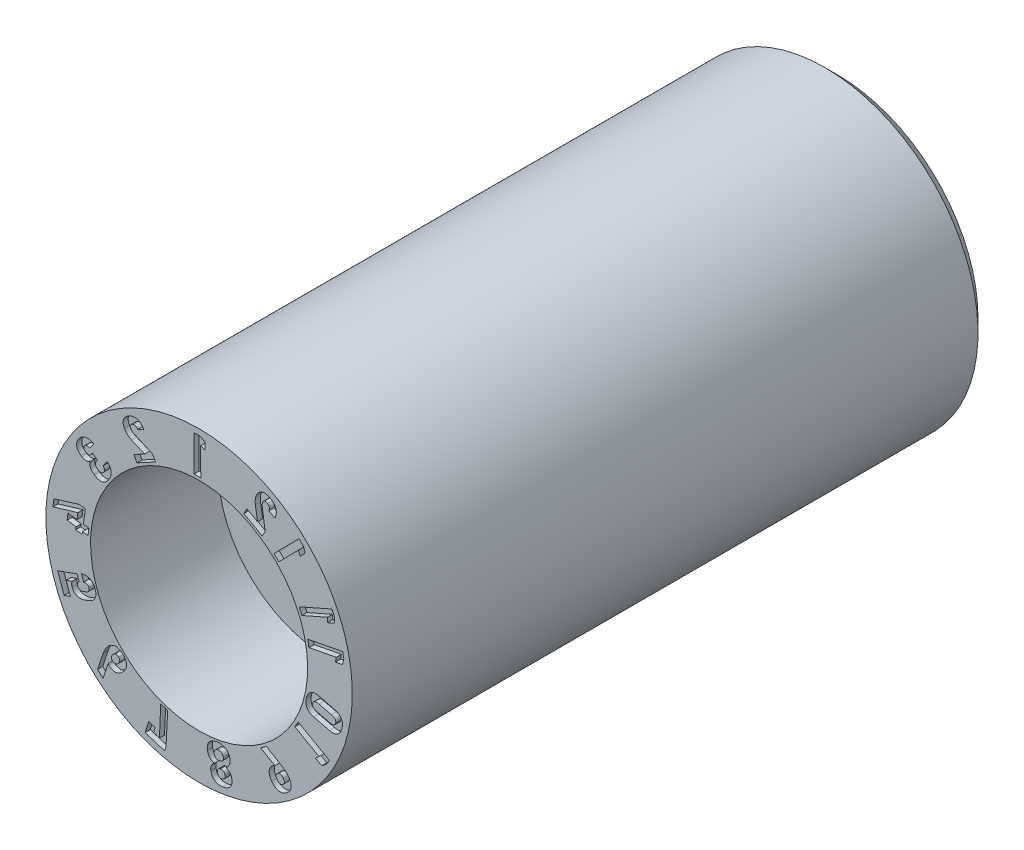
SolidWorks part; units mm, degrees
ref_plane "Front Plane" through (0, 0, 0) normal (0, 0, 1) x (1, 0, 0)
ref_plane "Top Plane" through (0, 0, 0) normal (0, 1, 0) x (1, 0, 0)
ref_plane "Right Plane" through (0, 0, 0) normal (1, 0, 0) x (0, 0, -1)
sketch "Sketch1" plane through (0, 0, 0) normal (1, 0, 0) x (0, 0, -1)
  line L0 (0, 0) -> (9.6542, 0) construction
  line L2 (25, 3) -> (25, 5.5)
  line L4 (24.5, 6) -> (0, 6)
  line L5 (0, 6) -> (0, 4.25)
  line L7 (0, 4.25) -> (5, 4.25)
  line L8 (5, 4.25) -> (5, 1.5)
  line L9 (5, 1.5) -> (18, 1.5)
  line L10 (25, 3) -> (18, 3)
  line L11 (18, 1.5) -> (18, 3)
  line L12 (25, 5.5) -> (24.5, 6)
  point P6 (25, 6)
  dimension "D1" = 25
  dimension "D2" = 12
  dimension "D3" = 8.5
  dimension "D4" = 5
  dimension "D5" = 3
  dimension "D6" = 6
  dimension "D7" = 7
revolve "Revolve1" add sketch "Sketch1" angle 360 about L0
sketch "Sketch2" plane through (0, 0, 0) normal (0, 0, 1) x (1, 0, 0)
  line L0 (-0.1978, 4.3616) -> (0.0666, 4.3632)
  line L1 (0.0666, 4.3632) -> (0.0607, 5.4564)
  line L2 (0.0607, 5.4564) -> (0.2322, 5.3923)
  line L3 (0.2322, 5.3923) -> (0.2307, 5.6736)
  line L4 (0.2307, 5.6736) -> (0.0206, 5.7669)
  line L5 (0.0206, 5.7669) -> (-0.2052, 5.7656)
  line L6 (-0.2052, 5.7656) -> (-0.1978, 4.3616)
  line L7 (-1.8183, 4.2261) -> (-2.5405, 4.5533)
  line L8 (-2.6815, 4.6706) -> (-2.6825, 4.6723)
  line L9 (-2.4005, 4.7723) -> (-2.4001, 4.7714)
  line L10 (-2.4001, 4.7714) -> (-2.1623, 4.8998)
  line L11 (-2.1623, 4.8998) -> (-2.1627, 4.9007)
  line L12 (-2.9247, 4.5502) -> (-2.9243, 4.5492)
  line L13 (-2.643, 4.2936) -> (-2.1333, 4.0748)
  line L14 (-2.1333, 4.0748) -> (-2.554, 3.8474)
  line L15 (-2.554, 3.8474) -> (-2.4333, 3.6239)
  line L16 (-2.4333, 3.6239) -> (-1.7055, 4.017)
  line L17 (-1.7055, 4.017) -> (-1.8183, 4.2261)
  line L18 (-3.6024, 3.083) -> (-3.7584, 2.8613)
  line L19 (-3.9522, 2.6271) -> (-3.9789, 2.6457)
  line L20 (-4.0412, 2.8455) -> (-3.9734, 2.9421)
  line L21 (-3.9734, 2.9421) -> (-4.1805, 3.0877)
  line L22 (-4.1805, 3.0877) -> (-4.2483, 2.9911)
  line L23 (-4.4264, 2.9882) -> (-4.4456, 3.0019)
  line L24 (-4.281, 3.2016) -> (-4.1257, 3.4228)
  line L25 (-4.6298, 2.7867) -> (-4.5953, 2.7624)
  line L26 (-4.1243, 2.4038) -> (-4.0898, 2.3795)
  line L27 (-4.6938, 1.0856) -> (-5.6844, 0.7836)
  line L28 (-5.6844, 0.7836) -> (-5.7241, 0.488)
  line L29 (-5.7241, 0.488) -> (-4.7466, 0.78)
  line L30 (-4.7466, 0.78) -> (-4.7805, 0.527)
  line L31 (-4.8301, 0.157) -> (-4.5784, 0.1231)
  line L32 (-4.5784, 0.1231) -> (-4.5638, 0.2318)
  line L33 (-4.4535, 1.0534) -> (-4.6938, 1.0856)
  line L34 (-5.1318, 0.5742) -> (-5.1669, 0.3128)
  line L35 (-5.1669, 0.3128) -> (-4.8155, 0.2656)
  line L36 (-4.3502, 0.2031) -> (-4.3152, 0.4645)
  line L37 (-4.3152, 0.4645) -> (-4.5287, 0.4932)
  line L38 (-4.6071, -1.2176) -> (-4.6079, -1.2179)
  line L39 (-4.6079, -1.2179) -> (-4.5183, -1.4672)
  line L40 (-4.5183, -1.4672) -> (-4.5174, -1.4668)
  line L41 (-4.4271, -1.7492) -> (-4.538, -1.7891)
  line L42 (-4.6929, -1.5442) -> (-4.7767, -1.3115)
  line L43 (-4.7767, -1.3115) -> (-5.5365, -1.585)
  line L44 (-5.5365, -1.585) -> (-5.2809, -2.2949)
  line L45 (-5.2809, -2.2949) -> (-5.0409, -2.2084)
  line L46 (-5.0409, -2.2084) -> (-5.2069, -1.7477)
  line L47 (-5.2069, -1.7477) -> (-4.9734, -1.6636)
  line L48 (-4.4483, -2.0384) -> (-4.3374, -1.9984)
  line L49 (-3.5682, -3.1669) -> (-3.5687, -3.1675)
  line L50 (-3.7645, -3.5148) -> (-3.9732, -4.1458)
  line L51 (-3.9732, -4.1458) -> (-3.7569, -4.3508)
  line L52 (-3.7569, -4.3508) -> (-3.5638, -3.7468)
  line L54 (-2.979, -3.7333) -> (-2.9785, -3.7327)
  line L55 (-3.158, -3.5396) -> (-3.1588, -3.5405)
  line L56 (-3.3689, -3.3394) -> (-3.3684, -3.3388)
  line L57 (-1.2952, -5.4331) -> (-1.2278, -4.1706)
  line L58 (-1.2278, -4.1706) -> (-1.5007, -4.0851)
  line L59 (-1.5007, -4.0851) -> (-1.5536, -5.2693)
  line L60 (-1.5536, -5.2693) -> (-1.783, -5.1971)
  line L61 (-1.783, -5.1971) -> (-1.72, -4.9958)
  line L62 (-1.72, -4.9958) -> (-1.9718, -4.917)
  line L63 (-1.9718, -4.917) -> (-2.111, -5.3609)
  line L64 (-2.111, -5.3609) -> (-1.3477, -5.6003)
  line L65 (-1.3477, -5.6003) -> (-1.2952, -5.4331)
  line L66 (0.3251, -4.7254) -> (0.3289, -4.7482)
  line L67 (0.457, -5.3502) -> (0.4629, -5.3865)
  line L68 (1.2851, -5.2516) -> (1.2792, -5.2154)
  line L69 (1.2081, -4.6038) -> (1.2043, -4.581)
  line L70 (0.9492, -4.6618) -> (0.9516, -4.6752)
  line L71 (0.5947, -4.733) -> (0.5924, -4.7188)
  line L72 (1.0162, -5.2477) -> (1.0183, -5.2611)
  line L73 (0.7186, -5.3091) -> (0.7162, -5.2948)
  line L75 (2.8434, -4.5302) -> (2.8441, -4.531)
  line L76 (3.5021, -4.0395) -> (3.5017, -4.0391)
  line L77 (3.1959, -3.7908) -> (2.637, -3.4559)
  line L78 (2.637, -3.4559) -> (2.412, -3.622)
  line L79 (2.412, -3.622) -> (2.9688, -3.9429)
  line L80 (3.2964, -4.2058) -> (3.297, -4.2069)
  line L81 (3.061, -4.3795) -> (3.0604, -4.3787)
  line L82 (3.8791, -2.0036) -> (3.7488, -2.2328)
  line L83 (3.7488, -2.2328) -> (4.6977, -2.7714)
  line L84 (4.6977, -2.7714) -> (4.5573, -2.888)
  line L85 (4.5573, -2.888) -> (4.8014, -3.0264)
  line L86 (4.8014, -3.0264) -> (4.9868, -2.8912)
  line L87 (4.9868, -2.8912) -> (5.0981, -2.6952)
  line L88 (5.0981, -2.6952) -> (3.8791, -2.0036)
  line L89 (4.4892, -1.5312) -> (5.1078, -1.6828)
  line L90 (5.3076, -0.8689) -> (4.6889, -0.7172)
  line L91 (4.6916, -0.9897) -> (5.1791, -1.1092)
  line L92 (5.1052, -1.4103) -> (4.6177, -1.2909)
  line L93 (4.2522, 0.9883) -> (4.302, 0.7293)
  line L94 (4.302, 0.7293) -> (5.3716, 0.9348)
  line L95 (5.3716, 0.9348) -> (5.3404, 0.7554)
  line L96 (5.3404, 0.7554) -> (5.6152, 0.8084)
  line L97 (5.6152, 0.8084) -> (5.6683, 1.0311)
  line L98 (5.6683, 1.0311) -> (5.6258, 1.2522)
  line L99 (5.6258, 1.2522) -> (4.2522, 0.9883)
  line L100 (3.9208, 1.9201) -> (4.0278, 1.6782)
  line L101 (4.0278, 1.6782) -> (5.0264, 2.1199)
  line L102 (5.0264, 2.1199) -> (5.0364, 1.9378)
  line L103 (5.0364, 1.9378) -> (5.2931, 2.0512)
  line L104 (5.2931, 2.0512) -> (5.295, 2.2808)
  line L105 (5.295, 2.2808) -> (5.2037, 2.4872)
  line L106 (5.2037, 2.4872) -> (3.9208, 1.9201)
  line L107 (2.9353, 3.2325) -> (3.1233, 3.0474)
  line L108 (3.1233, 3.0474) -> (3.8876, 3.8238)
  line L109 (3.8876, 3.8238) -> (3.9639, 3.6584)
  line L110 (3.9639, 3.6584) -> (4.1603, 3.858)
  line L111 (4.1603, 3.858) -> (4.0774, 4.0721)
  line L112 (4.0774, 4.0721) -> (3.917, 4.23)
  line L113 (3.917, 4.23) -> (2.9353, 3.2325)
  line L114 (2.5868, 3.8042) -> (2.4755, 4.5868)
  line L115 (2.4987, 4.7685) -> (2.4996, 4.7697)
  line L116 (2.734, 4.5859) -> (2.7336, 4.585)
  line L117 (2.7336, 4.585) -> (2.9692, 4.4536)
  line L118 (2.9692, 4.4536) -> (2.9696, 4.4545)
  line L119 (2.2672, 4.9085) -> (2.2668, 4.9075)
  line L120 (2.2021, 4.5337) -> (2.2905, 3.9883)
  line L121 (2.2905, 3.9883) -> (1.8741, 4.2206)
  line L122 (1.8741, 4.2206) -> (1.7506, 3.9993)
  line L123 (1.7506, 3.9993) -> (2.4712, 3.5972)
  line L124 (2.4712, 3.5972) -> (2.5868, 3.8042)
  line L125 (-4.8155, 0.2656) -> (-4.8301, 0.157)
  line L126 (-4.7805, 0.527) -> (-5.1318, 0.5742)
  line L127 (-4.5638, 0.2318) -> (-4.3502, 0.2031)
  line L128 (-4.5287, 0.4932) -> (-4.4535, 1.0534)
  circle A0 centre (0, 0) radius 4.375 construction
  spline S0 degree 3 poles (-2.5405, 4.5533) (-2.5708, 4.5672) (-2.6075, 4.5879) (-2.6434, 4.6209) (-2.6631, 4.6416) (-2.6751, 4.6588) (-2.6815, 4.6706) knots 0 0 0 0 0.540031 0.665532 0.783527 1 1 1 1
  spline S1 degree 3 poles (-2.6825, 4.6723) (-2.691, 4.6872) (-2.6992, 4.7113) (-2.6988, 4.7442) (-2.6926, 4.7672) (-2.6809, 4.789) (-2.657, 4.8174) (-2.6325, 4.8334) (-2.6149, 4.843) knots 0 0 0 0 0.246786 0.35691 0.469448 0.586307 0.710254 1 1 1 1
  spline S2 degree 3 poles (-2.6149, 4.843) (-2.5973, 4.8524) (-2.5688, 4.8625) (-2.5294, 4.8627) (-2.5009, 4.8563) (-2.4734, 4.8439) (-2.4367, 4.8186) (-2.4141, 4.7919) (-2.4005, 4.7723) knots 0 0 0 0 0.240301 0.353786 0.468513 0.587497 0.712892 1 1 1 1
  spline S3 degree 3 poles (-2.1627, 4.9007) (-2.1846, 4.9354) (-2.2212, 4.9835) (-2.2789, 5.0369) (-2.3239, 5.0689) (-2.3711, 5.0942) (-2.4201, 5.1126) (-2.4708, 5.1229) (-2.5228, 5.1266) (-2.5756, 5.1229) (-2.648, 5.1073) (-2.7004, 5.0859) (-2.734, 5.0675) knots 0 0 0 0 0.185247 0.270908 0.353799 0.433963 0.511943 0.589015 0.666847 0.746166 0.827199 1 1 1 1
  spline S4 degree 3 poles (-2.734, 5.0675) (-2.7696, 5.0481) (-2.8196, 5.016) (-2.8765, 4.9646) (-2.9108, 4.9247) (-2.9382, 4.8828) (-2.9584, 4.839) (-2.9717, 4.7936) (-2.9769, 4.7464) (-2.9753, 4.6981) (-2.9621, 4.6306) (-2.9418, 4.5818) (-2.9247, 4.5502) knots 0 0 0 0 0.194583 0.283015 0.366623 0.445927 0.521986 0.596945 0.671952 0.748458 0.827747 1 1 1 1
  spline S5 degree 3 poles (-2.9243, 4.5492) (-2.9089, 4.5214) (-2.8827, 4.481) (-2.8403, 4.4325) (-2.8057, 4.398) (-2.7682, 4.3665) (-2.715, 4.3295) (-2.6726, 4.3062) (-2.643, 4.2936) knots 0 0 0 0 0.246636 0.37153 0.498651 0.625609 0.751024 1 1 1 1
  spline S6 degree 3 poles (-3.5398, 2.4933) (-3.5166, 2.526) (-3.4869, 2.5773) (-3.46, 2.6499) (-3.447, 2.7034) (-3.4407, 2.7567) (-3.4423, 2.8092) (-3.4506, 2.8606) (-3.4662, 2.9108) (-3.4893, 2.9587) (-3.5308, 3.0203) (-3.5722, 3.0595) (-3.6024, 3.083) knots 0 0 0 0 0.181513 0.26641 0.349352 0.42998 0.508355 0.58625 0.665066 0.745087 0.826278 1 1 1 1
  spline S7 degree 3 poles (-3.7584, 2.8613) (-3.7484, 2.852) (-3.7348, 2.8371) (-3.7206, 2.8151) (-3.7123, 2.7987) (-3.707, 2.7817) (-3.7035, 2.7647) (-3.7026, 2.7476) (-3.7036, 2.7303) (-3.7072, 2.7132) (-3.7154, 2.6901) (-3.7246, 2.6737) (-3.732, 2.6633) knots 0 0 0 0 0.185669 0.27185 0.355025 0.435165 0.512269 0.590352 0.667877 0.746758 0.826658 1 1 1 1
  spline S8 degree 3 poles (-3.732, 2.6633) (-3.7447, 2.645) (-3.7669, 2.6203) (-3.804, 2.5999) (-3.8324, 2.5918) (-3.8621, 2.5903) (-3.9043, 2.5982) (-3.9337, 2.6142) (-3.9522, 2.6271) knots 0 0 0 0 0.265738 0.383017 0.496928 0.612242 0.731703 1 1 1 1
  spline S9 degree 3 poles (-3.9789, 2.6457) (-3.9981, 2.6595) (-4.0248, 2.6812) (-4.0496, 2.7168) (-4.0609, 2.7427) (-4.0664, 2.769) (-4.0639, 2.8053) (-4.0521, 2.8306) (-4.0412, 2.8455) knots 0 0 0 0 0.300575 0.428718 0.545676 0.656478 0.765355 1 1 1 1
  spline S10 degree 3 poles (-4.2483, 2.9911) (-4.2566, 2.9784) (-4.2735, 2.9628) (-4.3014, 2.9512) (-4.3241, 2.9485) (-4.3484, 2.9512) (-4.3843, 2.9616) (-4.4098, 2.9766) (-4.4264, 2.9882) knots 0 0 0 0 0.226778 0.333314 0.445235 0.564595 0.695767 1 1 1 1
  spline S11 degree 3 poles (-4.4456, 3.0019) (-4.4612, 3.0131) (-4.4828, 3.0311) (-4.502, 3.061) (-4.5105, 3.0832) (-4.5134, 3.106) (-4.5102, 3.1377) (-4.4991, 3.1599) (-4.4894, 3.1732) knots 0 0 0 0 0.288125 0.411925 0.528489 0.640573 0.752467 1 1 1 1
  spline S12 degree 3 poles (-4.4894, 3.1732) (-4.4828, 3.1826) (-4.4713, 3.1957) (-4.4524, 3.2084) (-4.4374, 3.2165) (-4.4208, 3.2218) (-4.4035, 3.226) (-4.3849, 3.2267) (-4.3655, 3.2263) (-4.3453, 3.2234) (-4.3165, 3.2166) (-4.2953, 3.208) (-4.281, 3.2016) knots 0 0 0 0 0.150328 0.223515 0.297446 0.371959 0.449583 0.529747 0.613909 0.702218 0.795553 1 1 1 1
  spline S13 degree 3 poles (-4.1257, 3.4228) (-4.1607, 3.4428) (-4.2147, 3.468) (-4.2899, 3.4872) (-4.3445, 3.4941) (-4.3979, 3.494) (-4.4497, 3.4876) (-4.4994, 3.4735) (-4.5468, 3.453) (-4.5917, 3.4265) (-4.6477, 3.3827) (-4.6832, 3.3419) (-4.7039, 3.3122) knots 0 0 0 0 0.185403 0.271955 0.355808 0.43751 0.516725 0.595164 0.673981 0.753613 0.833638 1 1 1 1
  spline S14 degree 3 poles (-4.7039, 3.3122) (-4.7205, 3.2882) (-4.7432, 3.2519) (-4.7664, 3.2015) (-4.7794, 3.1651) (-4.7883, 3.129) (-4.7936, 3.0934) (-4.7947, 3.0582) (-4.7916, 3.0237) (-4.785, 2.9899) (-4.7744, 2.9571) (-4.7599, 2.9255) (-4.7417, 2.895) (-4.7191, 2.8661) (-4.6836, 2.8277) (-4.6521, 2.8026) (-4.6298, 2.7867) knots 0 0 0 0 0.145221 0.212039 0.275498 0.336822 0.396212 0.454116 0.511301 0.568162 0.624888 0.681779 0.740523 0.801036 0.863692 1 1 1 1
  spline S15 degree 3 poles (-4.5953, 2.7624) (-4.5703, 2.7451) (-4.5303, 2.723) (-4.4725, 2.7087) (-4.4293, 2.7043) (-4.386, 2.7071) (-4.3276, 2.7201) (-4.2868, 2.7408) (-4.2612, 2.7575) knots 0 0 0 0 0.256538 0.378141 0.499462 0.620241 0.742004 1 1 1 1
  spline S16 degree 3 poles (-4.2612, 2.7575) (-4.2678, 2.7423) (-4.2749, 2.7186) (-4.28, 2.6864) (-4.282, 2.6627) (-4.2811, 2.6391) (-4.2777, 2.6157) (-4.2724, 2.5922) (-4.2646, 2.569) (-4.2546, 2.5462) (-4.2422, 2.524) (-4.2281, 2.5022) (-4.2115, 2.4813) (-4.193, 2.4608) (-4.1646, 2.4338) (-4.1408, 2.4156) (-4.1243, 2.4038) knots 0 0 0 0 0.120514 0.178963 0.236486 0.293076 0.350257 0.408016 0.467449 0.527699 0.589262 0.651768 0.715782 0.783012 0.852532 1 1 1 1
  spline S17 degree 3 poles (-4.0898, 2.3795) (-4.0589, 2.3576) (-4.0104, 2.3298) (-3.942, 2.307) (-3.8925, 2.2977) (-3.8435, 2.2958) (-3.7955, 2.3023) (-3.7484, 2.3158) (-3.7027, 2.337) (-3.6586, 2.3657) (-3.6006, 2.415) (-3.5629, 2.4604) (-3.5398, 2.4933) knots 0 0 0 0 0.178207 0.259967 0.338031 0.414007 0.489005 0.564651 0.643104 0.724692 0.8109 1 1 1 1
  spline S18 degree 3 poles (-4.0723, -1.4624) (-4.084, -1.4281) (-4.1085, -1.3804) (-4.1506, -1.3236) (-4.1871, -1.2871) (-4.228, -1.2559) (-4.2729, -1.2309) (-4.3216, -1.2118) (-4.3738, -1.1994) (-4.4292, -1.1936) (-4.5081, -1.1947) (-4.5676, -1.2063) (-4.6071, -1.2176) knots 0 0 0 0 0.165263 0.244175 0.322923 0.400785 0.478837 0.557609 0.639406 0.724106 0.811786 1 1 1 1
  spline S19 degree 3 poles (-4.5174, -1.4668) (-4.4947, -1.4606) (-4.4607, -1.4564) (-4.4169, -1.4607) (-4.3883, -1.4696) (-4.3628, -1.4833) (-4.3341, -1.5092) (-4.3191, -1.5346) (-4.3128, -1.5533) knots 0 0 0 0 0.286425 0.412421 0.532755 0.648554 0.760969 1 1 1 1
  spline S20 degree 3 poles (-4.3128, -1.5533) (-4.3056, -1.5729) (-4.2994, -1.6038) (-4.3063, -1.6439) (-4.3184, -1.6707) (-4.3369, -1.695) (-4.3709, -1.7257) (-4.4042, -1.7403) (-4.4271, -1.7492) knots 0 0 0 0 0.244768 0.357262 0.468879 0.585371 0.710839 1 1 1 1
  spline S21 degree 3 poles (-4.538, -1.7891) (-4.5611, -1.7978) (-4.5956, -1.8064) (-4.6406, -1.8071) (-4.6695, -1.8012) (-4.695, -1.7904) (-4.7243, -1.7675) (-4.7382, -1.7426) (-4.7446, -1.725) knots 0 0 0 0 0.302893 0.431393 0.55004 0.661203 0.768793 1 1 1 1
  spline S22 degree 3 poles (-4.7446, -1.725) (-4.7507, -1.7083) (-4.7566, -1.6825) (-4.7559, -1.648) (-4.7512, -1.6237) (-4.7424, -1.6007) (-4.7252, -1.5719) (-4.7068, -1.5541) (-4.6929, -1.5442) knots 0 0 0 0 0.263348 0.385872 0.507659 0.627206 0.748083 1 1 1 1
  spline S23 degree 3 poles (-4.9734, -1.6636) (-4.9794, -1.677) (-4.9855, -1.699) (-4.989, -1.7303) (-4.9891, -1.7561) (-4.9872, -1.7826) (-4.9823, -1.8172) (-4.9756, -1.8424) (-4.9699, -1.8586) knots 0 0 0 0 0.220311 0.341953 0.473175 0.608808 0.741307 1 1 1 1
  spline S24 degree 3 poles (-4.9699, -1.8586) (-4.9586, -1.8907) (-4.9362, -1.9359) (-4.8949, -1.9869) (-4.8602, -2.0183) (-4.8211, -2.0436) (-4.7778, -2.0622) (-4.7308, -2.0744) (-4.68, -2.0801) (-4.6261, -2.0795) (-4.5473, -2.0695) (-4.4881, -2.0525) (-4.4483, -2.0384) knots 0 0 0 0 0.163572 0.239328 0.313613 0.387363 0.461653 0.538789 0.6198 0.70611 0.797006 1 1 1 1
  spline S25 degree 3 poles (-4.3374, -1.9984) (-4.2974, -1.9845) (-4.2413, -1.9582) (-4.1752, -1.9127) (-4.1345, -1.875) (-4.1006, -1.8339) (-4.0741, -1.7892) (-4.0546, -1.7414) (-4.0429, -1.6903) (-4.0387, -1.6364) (-4.0431, -1.5589) (-4.059, -1.5009) (-4.0723, -1.4624) knots 0 0 0 0 0.18694 0.272023 0.353193 0.431093 0.506534 0.581498 0.658173 0.737159 0.819461 1 1 1 1
  spline S26 degree 3 poles (-2.9815, -3.1418) (-3.0105, -3.1143) (-3.0568, -3.0778) (-3.1244, -3.0425) (-3.1747, -3.0248) (-3.2253, -3.0153) (-3.2761, -3.0134) (-3.3268, -3.0196) (-3.3774, -3.0333) (-3.4271, -3.0554) (-3.4943, -3.0962) (-3.5394, -3.137) (-3.5682, -3.1669) knots 0 0 0 0 0.180127 0.262705 0.342108 0.418644 0.493746 0.569602 0.647518 0.728441 0.81338 1 1 1 1
  spline S27 degree 3 poles (-3.5687, -3.1675) (-3.5868, -3.1864) (-3.6122, -3.2171) (-3.6433, -3.2611) (-3.6902, -3.3347) (-3.7218, -3.4014) (-3.7435, -3.4566) knots 0 0 0 0 0.230619 0.351394 0.476039 1 1 1 1
  spline S28 degree 3 poles (-3.7435, -3.4566) (-3.7473, -3.4663) (-3.7553, -3.4853) (-3.7612, -3.5051) (-3.7645, -3.5148) knots 0 0 0 0 0.50536 1 1 1 1
  spline S29 degree 3 poles (-3.5638, -3.7468) (-3.5539, -3.7607) (-3.5424, -3.7734) (-3.5301, -3.7852) knots 0.758677 0.758677 0.758677 0.758677 1 1 1 1
  spline S30 degree 3 poles (-3.5301, -3.7852) (-3.5041, -3.8101) (-3.4622, -3.8424) (-3.4003, -3.8721) (-3.3541, -3.8862) (-3.3071, -3.8933) (-3.2595, -3.892) (-3.2116, -3.8839) (-3.1639, -3.8679) (-3.1162, -3.8452) (-3.0517, -3.8029) (-3.0068, -3.7634) (-2.979, -3.7333) knots 0 0 0 0 0.171863 0.250291 0.326567 0.401554 0.476517 0.552896 0.632432 0.716094 0.804581 1 1 1 1
  spline S31 degree 3 poles (-2.9785, -3.7327) (-2.9494, -3.7027) (-2.9112, -3.6546) (-2.8733, -3.5849) (-2.8537, -3.5335) (-2.8417, -3.4821) (-2.8379, -3.4307) (-2.8422, -3.3797) (-2.8547, -3.3295) (-2.8748, -3.2801) (-2.9133, -3.214) (-2.9522, -3.1695) (-2.9815, -3.1418) knots 0 0 0 0 0.186979 0.272364 0.353583 0.431717 0.507486 0.58272 0.659285 0.738013 0.820087 1 1 1 1
  spline S32 degree 3 poles (-3.1562, -3.3258) (-3.1409, -3.3402) (-3.1211, -3.3642) (-3.1075, -3.4018) (-3.1048, -3.4298) (-3.1083, -3.458) (-3.1224, -3.4974) (-3.1427, -3.5233) (-3.158, -3.5396) knots 0 0 0 0 0.260004 0.375028 0.487763 0.603253 0.723686 1 1 1 1
  spline S33 degree 3 poles (-3.1588, -3.5405) (-3.1766, -3.5588) (-3.2044, -3.5837) (-3.2468, -3.6043) (-3.2771, -3.6118) (-3.307, -3.6123) (-3.3469, -3.603) (-3.3731, -3.5848) (-3.3884, -3.5703) knots 0 0 0 0 0.294329 0.419072 0.536316 0.647266 0.758044 1 1 1 1
  spline S34 degree 3 poles (-3.3884, -3.5703) (-3.4041, -3.5563) (-3.4223, -3.5307) (-3.434, -3.4915) (-3.4343, -3.4614) (-3.4278, -3.4307) (-3.4094, -3.3872) (-3.3864, -3.3579) (-3.3689, -3.3394) knots 0 0 0 0 0.240144 0.350681 0.462749 0.580659 0.707141 1 1 1 1
  spline S35 degree 3 poles (-3.3684, -3.3388) (-3.353, -3.3226) (-3.328, -3.3016) (-3.2899, -3.285) (-3.262, -3.28) (-3.2342, -3.282) (-3.1961, -3.2928) (-3.1714, -3.3119) (-3.1562, -3.3258) knots 0 0 0 0 0.277582 0.398175 0.512355 0.625221 0.741294 1 1 1 1
  spline S36 degree 3 poles (0.7015, -4.2678) (0.6601, -4.2748) (0.5999, -4.2896) (0.5266, -4.3231) (0.478, -4.3522) (0.4351, -4.3861) (0.3983, -4.4243) (0.3685, -4.4669) (0.345, -4.5132) (0.3285, -4.5628) (0.3164, -4.6339) (0.3191, -4.6889) (0.3251, -4.7254) knots 0 0 0 0 0.188911 0.276657 0.361678 0.443562 0.521838 0.599287 0.676742 0.754956 0.833257 1 1 1 1
  spline S37 degree 3 poles (0.3289, -4.7482) (0.3344, -4.7822) (0.35, -4.8322) (0.3847, -4.8929) (0.4172, -4.9351) (0.4551, -4.9728) (0.5114, -5.0155) (0.56, -5.0372) (0.5935, -5.0475) knots 0 0 0 0 0.245718 0.369513 0.497226 0.624714 0.74972 1 1 1 1
  spline S38 degree 3 poles (0.5935, -5.0475) (0.5692, -5.0649) (0.5355, -5.0952) (0.5007, -5.1439) (0.4795, -5.1831) (0.4643, -5.2243) (0.4517, -5.2799) (0.4526, -5.3226) (0.457, -5.3502) knots 0 0 0 0 0.257022 0.384551 0.512171 0.638121 0.760049 1 1 1 1
  spline S39 degree 3 poles (0.4629, -5.3865) (0.4687, -5.4207) (0.4825, -5.4709) (0.5151, -5.5306) (0.5442, -5.5703) (0.5793, -5.6043) (0.6185, -5.6339) (0.6627, -5.657) (0.7107, -5.675) (0.7625, -5.6868) (0.8374, -5.6939) (0.8951, -5.6899) (0.9338, -5.6834) knots 0 0 0 0 0.166755 0.246297 0.324383 0.402008 0.479602 0.558559 0.640169 0.724632 0.812105 1 1 1 1
  spline S40 degree 3 poles (0.9338, -5.6834) (0.9724, -5.6767) (1.0287, -5.663) (1.0972, -5.6317) (1.1425, -5.6039) (1.1822, -5.5714) (1.2168, -5.5356) (1.2446, -5.4952) (1.2666, -5.4516) (1.2818, -5.4048) (1.2937, -5.3379) (1.2908, -5.286) (1.2851, -5.2516) knots 0 0 0 0 0.187909 0.275417 0.360083 0.441841 0.520725 0.597915 0.675567 0.754033 0.832948 1 1 1 1
  spline S41 degree 3 poles (1.2792, -5.2154) (1.2747, -5.1873) (1.2614, -5.1462) (1.2313, -5.097) (1.2029, -5.0632) (1.1703, -5.0328) (1.1212, -4.9983) (1.0795, -4.9806) (1.0505, -4.9724) knots 0 0 0 0 0.242453 0.363868 0.489952 0.617354 0.74325 1 1 1 1
  spline S42 degree 3 poles (1.0505, -4.9724) (1.0796, -4.9521) (1.1184, -4.9152) (1.159, -4.8569) (1.1829, -4.809) (1.201, -4.7589) (1.2147, -4.6903) (1.2139, -4.6379) (1.2081, -4.6038) knots 0 0 0 0 0.252158 0.376884 0.504108 0.631296 0.754622 1 1 1 1
  spline S43 degree 3 poles (1.2043, -4.581) (1.1981, -4.5446) (1.1837, -4.4913) (1.149, -4.4282) (1.1179, -4.3864) (1.081, -4.3499) (1.0388, -4.3193) (0.9917, -4.2947) (0.9401, -4.2763) (0.8847, -4.2639) (0.8045, -4.2564) (0.7428, -4.2608) (0.7015, -4.2678) knots 0 0 0 0 0.166471 0.245115 0.32305 0.400163 0.477805 0.556488 0.638411 0.723458 0.81117 1 1 1 1
  spline S44 degree 3 poles (0.7429, -4.5197) (0.7595, -4.5167) (0.7844, -4.5152) (0.8167, -4.5195) (0.8393, -4.5255) (0.8604, -4.5342) (0.8799, -4.5452) (0.8972, -4.5595) (0.9126, -4.5758) (0.9259, -4.5944) (0.9402, -4.6225) (0.9464, -4.6459) (0.9492, -4.6618) knots 0 0 0 0 0.179082 0.263836 0.346473 0.426937 0.506638 0.584521 0.664787 0.745258 0.82724 1 1 1 1
  spline S45 degree 3 poles (0.9516, -4.6752) (0.9541, -4.69) (0.955, -4.7124) (0.95, -4.7413) (0.9432, -4.7615) (0.9333, -4.7801) (0.9214, -4.7976) (0.9064, -4.8132) (0.8892, -4.8271) (0.8697, -4.8391) (0.8399, -4.8522) (0.8158, -4.8586) (0.799, -4.8611) knots 0 0 0 0 0.166565 0.24586 0.324124 0.401703 0.479332 0.558127 0.640221 0.724653 0.811552 1 1 1 1
  spline S46 degree 3 poles (0.799, -4.8611) (0.7822, -4.8637) (0.7572, -4.8662) (0.7248, -4.8628) (0.7024, -4.8579) (0.6815, -4.8501) (0.6626, -4.8397) (0.6452, -4.8275) (0.6303, -4.8123) (0.6173, -4.7954) (0.6032, -4.7695) (0.5973, -4.7479) (0.5947, -4.733) knots 0 0 0 0 0.188247 0.274867 0.359836 0.441322 0.52022 0.597868 0.675487 0.754323 0.833355 1 1 1 1
  spline S47 degree 3 poles (0.5924, -4.7188) (0.5897, -4.7028) (0.5885, -4.6788) (0.593, -4.6477) (0.5998, -4.626) (0.6092, -4.6057) (0.621, -4.5869) (0.6361, -4.5705) (0.6532, -4.5555) (0.673, -4.5431) (0.7021, -4.5285) (0.7264, -4.5225) (0.7429, -4.5197) knots 0 0 0 0 0.17278 0.255069 0.335188 0.415003 0.493111 0.57141 0.652579 0.735418 0.820528 1 1 1 1
  spline S48 degree 3 poles (0.8404, -5.1148) (0.8546, -5.1129) (0.8759, -5.1109) (0.9034, -5.1155) (0.9226, -5.121) (0.9404, -5.1292) (0.9568, -5.1398) (0.9715, -5.1528) (0.9844, -5.1681) (0.9957, -5.1854) (1.0081, -5.2115) (1.0138, -5.2329) (1.0162, -5.2477) knots 0 0 0 0 0.173583 0.255392 0.335492 0.414428 0.492216 0.570546 0.651075 0.734215 0.818823 1 1 1 1
  spline S49 degree 3 poles (1.0183, -5.2611) (1.0206, -5.2749) (1.0218, -5.2955) (1.0179, -5.3222) (1.0128, -5.3409) (1.0051, -5.3582) (0.9952, -5.3741) (0.9828, -5.3883) (0.9684, -5.4009) (0.9522, -5.412) (0.927, -5.4233) (0.9069, -5.4296) (0.8926, -5.4314) knots 0 0 0 0 0.175701 0.257572 0.338547 0.418149 0.495516 0.57329 0.653732 0.735586 0.819888 1 1 1 1
  spline S50 degree 3 poles (0.8926, -5.4314) (0.8785, -5.4332) (0.8573, -5.4354) (0.83, -5.4315) (0.8108, -5.427) (0.793, -5.4198) (0.7768, -5.4098) (0.7622, -5.3978) (0.7492, -5.3837) (0.7384, -5.3674) (0.7266, -5.3429) (0.7208, -5.323) (0.7186, -5.3091) knots 0 0 0 0 0.179176 0.262722 0.344582 0.424728 0.502426 0.581003 0.660377 0.741777 0.824574 1 1 1 1
  spline S51 degree 3 poles (0.7162, -5.2948) (0.7138, -5.2804) (0.7127, -5.2587) (0.7156, -5.2305) (0.721, -5.2108) (0.7284, -5.1924) (0.7385, -5.1756) (0.7504, -5.1603) (0.7649, -5.147) (0.7812, -5.1355) (0.8058, -5.1226) (0.8264, -5.1173) (0.8404, -5.1148) knots 0 0 0 0 0.178389 0.262964 0.344996 0.426393 0.504519 0.583339 0.662244 0.743344 0.825531 1 1 1 1
  spline S52 degree 3 poles (2.9688, -3.9429) (2.9676, -3.9433) (2.9574, -3.9469) (2.9285, -3.9597) (2.9028, -3.9758) (2.886, -3.9882) knots 0.564366 0.564366 0.564366 0.564366 0.581965 0.713241 1 1 1 1
  spline S53 degree 3 poles (2.886, -3.9882) (2.8589, -4.0081) (2.8222, -4.0422) (2.7852, -4.0965) (2.7649, -4.1397) (2.7509, -4.1852) (2.7436, -4.2325) (2.7436, -4.2813) (2.75, -4.3313) (2.7635, -4.3818) (2.7907, -4.4507) (2.8205, -4.4992) (2.8434, -4.5302) knots 0 0 0 0 0.165213 0.243295 0.321098 0.398558 0.4759 0.554875 0.637363 0.722439 0.810763 1 1 1 1
  spline S54 degree 3 poles (2.8441, -4.531) (2.8693, -4.5648) (2.9098, -4.6118) (2.9724, -4.6617) (3.0197, -4.6906) (3.0686, -4.7115) (3.1188, -4.7242) (3.17, -4.7292) (3.222, -4.7256) (3.2744, -4.7144) (3.3464, -4.6875) (3.3973, -4.657) (3.4298, -4.6327) knots 0 0 0 0 0.187453 0.273103 0.354468 0.432526 0.508157 0.58355 0.659808 0.738585 0.820198 1 1 1 1
  spline S55 degree 3 poles (3.4298, -4.6327) (3.4622, -4.6088) (3.5065, -4.5694) (3.553, -4.5083) (3.5789, -4.4613) (3.5971, -4.4122) (3.6072, -4.3615) (3.6096, -4.3094) (3.6038, -4.2561) (3.59, -4.202) (3.5603, -4.1269) (3.5275, -4.0737) (3.5021, -4.0395) knots 0 0 0 0 0.178257 0.259594 0.33812 0.4147 0.489866 0.565782 0.643898 0.725895 0.811719 1 1 1 1
  spline S56 degree 3 poles (3.5017, -4.0391) (3.4872, -4.0192) (3.4626, -3.9906) (3.4258, -3.9549) (3.3946, -3.928) (3.3609, -3.9013) (3.3113, -3.8645) (3.2716, -3.8384) (3.2446, -3.8207) knots 0 0 0 0 0.216947 0.333216 0.45375 0.5803 0.714146 1 1 1 1
  spline S57 degree 3 poles (3.2446, -3.8207) (3.2366, -3.8154) (3.2204, -3.8054) (3.2044, -3.795) (3.1959, -3.7908) knots 0 0 0 0 0.502406 1 1 1 1
  spline S58 degree 3 poles (3.0768, -4.1542) (3.0934, -4.1414) (3.1213, -4.1271) (3.1616, -4.122) (3.1909, -4.1258) (3.2196, -4.1357) (3.2578, -4.1602) (3.2821, -4.1859) (3.2964, -4.2058) knots 0 0 0 0 0.246067 0.358457 0.471835 0.589083 0.712499 1 1 1 1
  spline S59 degree 3 poles (3.297, -4.2069) (3.3113, -4.2257) (3.3281, -4.2556) (3.3392, -4.298) (3.3398, -4.3275) (3.334, -4.3558) (3.3162, -4.3918) (3.2944, -4.4141) (3.2774, -4.4262) knots 0 0 0 0 0.283319 0.405631 0.522186 0.634485 0.748744 1 1 1 1
  spline S60 degree 3 poles (3.2774, -4.4262) (3.2604, -4.4385) (3.2329, -4.4541) (3.1927, -4.4595) (3.1639, -4.4568) (3.1359, -4.4471) (3.0984, -4.424) (3.0747, -4.3988) (3.061, -4.3795) knots 0 0 0 0 0.252249 0.365948 0.478304 0.594067 0.716781 1 1 1 1
  spline S61 degree 3 poles (3.0604, -4.3787) (3.046, -4.359) (3.0274, -4.3286) (3.0163, -4.2848) (3.0151, -4.2546) (3.0204, -4.2258) (3.0374, -4.1888) (3.0599, -4.1667) (3.0768, -4.1542) knots 0 0 0 0 0.287505 0.411242 0.527096 0.639457 0.752084 1 1 1 1
  spline S62 degree 3 poles (4.2025, -1.0293) (4.1947, -1.0606) (4.1866, -1.1071) (4.1828, -1.1682) (4.1845, -1.2105) (4.1899, -1.2507) (4.1992, -1.2887) (4.2129, -1.3244) (4.2302, -1.3579) (4.251, -1.389) (4.2752, -1.4176) (4.3029, -1.4431) (4.3337, -1.4662) (4.3677, -1.4868) (4.4189, -1.511) (4.4605, -1.524) (4.4892, -1.5312) knots 0 0 0 0 0.147114 0.214655 0.278552 0.340153 0.39914 0.456578 0.513845 0.570705 0.626912 0.684037 0.742067 0.802468 0.864949 1 1 1 1
  spline S63 degree 3 poles (5.1078, -1.6828) (5.1368, -1.6898) (5.1799, -1.6974) (5.2368, -1.6996) (5.2767, -1.6976) (5.3149, -1.6913) (5.3513, -1.6811) (5.3859, -1.667) (5.4187, -1.649) (5.4495, -1.6272) (5.4776, -1.6016) (5.5035, -1.5724) (5.5268, -1.5393) (5.5474, -1.5024) (5.5727, -1.4469) (5.5864, -1.4018) (5.594, -1.3706) knots 0 0 0 0 0.135933 0.198749 0.259181 0.317693 0.374727 0.431 0.487859 0.544848 0.602171 0.661143 0.722378 0.786127 0.853397 1 1 1 1
  spline S64 degree 3 poles (5.594, -1.3706) (5.6015, -1.3393) (5.6104, -1.2929) (5.6138, -1.2318) (5.6128, -1.1895) (5.6073, -1.1494) (5.5982, -1.1114) (5.585, -1.0757) (5.5682, -1.0422) (5.5473, -1.0115) (5.5232, -0.9831) (5.4958, -0.957) (5.4644, -0.9344) (5.4304, -0.9134) (5.3784, -0.8896) (5.3366, -0.876) (5.3076, -0.8689) knots 0 0 0 0 0.146813 0.214284 0.278279 0.339211 0.398462 0.455807 0.512307 0.56852 0.624668 0.68185 0.740176 0.800514 0.863812 1 1 1 1
  spline S65 degree 3 poles (4.6889, -0.7172) (4.66, -0.7102) (4.6168, -0.7026) (4.5599, -0.7004) (4.52, -0.7024) (4.4819, -0.7088) (4.4455, -0.7189) (4.4109, -0.7331) (4.3781, -0.7508) (4.3473, -0.7726) (4.3192, -0.7984) (4.2933, -0.8276) (4.27, -0.8608) (4.2494, -0.8976) (4.2241, -0.9531) (4.2104, -0.9982) (4.2025, -1.0293) knots 0 0 0 0 0.135939 0.198758 0.259192 0.317706 0.374742 0.431018 0.487519 0.544511 0.602243 0.661217 0.722455 0.786207 0.853479 1 1 1 1
  spline S66 degree 3 poles (4.4495, -1.0899) (4.4525, -1.0778) (4.4582, -1.0603) (4.4696, -1.0395) (4.4788, -1.0257) (4.4899, -1.0141) (4.5019, -1.0036) (4.5158, -0.9955) (4.5359, -0.9861) (4.5648, -0.9789) (4.6193, -0.9752) (4.6622, -0.9827) (4.6916, -0.9897) knots 0 0 0 0 0.125814 0.183206 0.23813 0.291732 0.344481 0.398117 0.45264 0.567735 0.694864 1 1 1 1
  spline S67 degree 3 poles (5.1791, -1.1092) (5.2086, -1.116) (5.2495, -1.1304) (5.2966, -1.1581) (5.3189, -1.178) (5.3325, -1.1956) (5.3409, -1.2093) (5.3466, -1.224) (5.3508, -1.2396) (5.3526, -1.256) (5.3534, -1.2798) (5.3497, -1.2979) (5.347, -1.31) knots 0 0 0 0 0.30454 0.432044 0.547816 0.602595 0.65542 0.70833 0.761154 0.81687 0.874657 1 1 1 1
  spline S68 degree 3 poles (5.347, -1.31) (5.3438, -1.322) (5.3387, -1.3397) (5.3271, -1.3605) (5.318, -1.3743) (5.3069, -1.3859) (5.2948, -1.3963) (5.2813, -1.4048) (5.261, -1.4141) (5.2319, -1.4209) (5.1774, -1.4255) (5.1345, -1.4168) (5.1052, -1.4103) knots 0 0 0 0 0.125854 0.18322 0.23812 0.291697 0.344423 0.397546 0.452045 0.567797 0.695375 1 1 1 1
  spline S69 degree 3 poles (4.6177, -1.2909) (4.5884, -1.2836) (4.547, -1.2702) (4.5003, -1.2419) (4.4781, -1.2221) (4.4645, -1.2045) (4.4561, -1.1908) (4.4501, -1.176) (4.4457, -1.1604) (4.4438, -1.1439) (4.4438, -1.1201) (4.4464, -1.102) (4.4495, -1.0899) knots 0 0 0 0 0.304459 0.431969 0.54676 0.601513 0.654312 0.707926 0.76137 0.817058 0.874364 1 1 1 1
  spline S70 degree 3 poles (2.4755, 4.5868) (2.4703, 4.6199) (2.4689, 4.6617) (2.477, 4.7097) (2.4843, 4.7374) (2.4922, 4.7567) (2.4987, 4.7685) knots 0 0 0 0 0.540472 0.665265 0.783373 1 1 1 1
  spline S71 degree 3 poles (2.4996, 4.7697) (2.5077, 4.7848) (2.5235, 4.8049) (2.5514, 4.8224) (2.5741, 4.8295) (2.5987, 4.831) (2.6353, 4.8266) (2.6617, 4.8137) (2.6793, 4.8047) knots 0 0 0 0 0.247786 0.358949 0.470787 0.5868 0.711755 1 1 1 1
  spline S72 degree 3 poles (2.6793, 4.8047) (2.6969, 4.7951) (2.7204, 4.7762) (2.7421, 4.7433) (2.7515, 4.7158) (2.7561, 4.6859) (2.754, 4.6413) (2.7433, 4.6079) (2.734, 4.5859) knots 0 0 0 0 0.240719 0.353528 0.46771 0.586635 0.713026 1 1 1 1
  spline S73 degree 3 poles (2.9696, 4.4545) (2.987, 4.4917) (3.0084, 4.5484) (3.0222, 4.6258) (3.0251, 4.6808) (3.0209, 4.7339) (3.0103, 4.7849) (2.9918, 4.8331) (2.9671, 4.8786) (2.9357, 4.9211) (2.884, 4.9736) (2.8378, 5.0061) (2.8045, 5.0247) knots 0 0 0 0 0.186124 0.272067 0.354665 0.434533 0.512657 0.589368 0.667373 0.746383 0.827501 1 1 1 1
  spline S74 degree 3 poles (2.8045, 5.0247) (2.7693, 5.0447) (2.7154, 5.0692) (2.6417, 5.0896) (2.5899, 5.0971) (2.54, 5.0977) (2.4923, 5.0916) (2.4471, 5.0777) (2.4043, 5.0575) (2.3646, 5.0301) (2.3147, 4.9832) (2.2848, 4.9396) (2.2672, 4.9085) knots 0 0 0 0 0.19471 0.282993 0.366389 0.445897 0.522009 0.596736 0.672148 0.748568 0.82781 1 1 1 1
  spline S75 degree 3 poles (2.2668, 4.9075) (2.2511, 4.8799) (2.2317, 4.836) (2.2134, 4.7745) (2.2032, 4.7267) (2.1969, 4.6782) (2.1938, 4.6136) (2.1972, 4.5654) (2.2021, 4.5337) knots 0 0 0 0 0.246607 0.371179 0.498175 0.625815 0.751251 1 1 1 1
  dimension "D1" = 8.75
extrude "Cut-Extrude1" cut sketch "Sketch2" against normal blind 0.2
